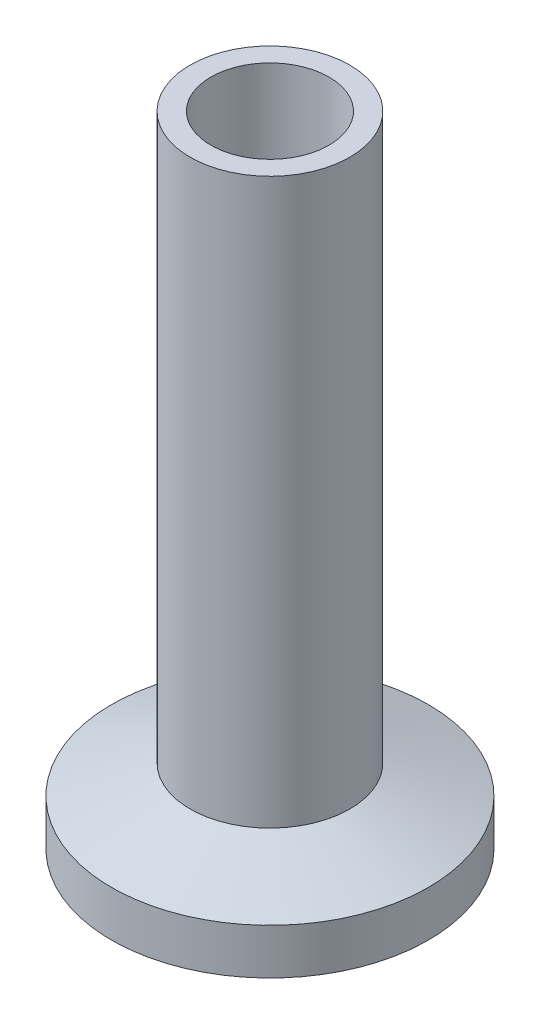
SolidWorks part; units mm, degrees
ref_plane "Front Plane" through (0, 0, 0) normal (0, 0, 1) x (1, 0, 0)
ref_plane "Top Plane" through (0, 0, 0) normal (0, 1, 0) x (1, 0, 0)
ref_plane "Right Plane" through (0, 0, 0) normal (1, 0, 0) x (0, 0, -1)
sketch "Sketch1" plane through (0, 0, 0) normal (0, 0, 1) x (1, 0, 0)
  line L0 (-4.699, 0.889) -> (-4.699, 50.8)
  line L1 (-4.699, 50.8) -> (-6.35, 50.8)
  line L2 (-6.35, 50.8) -> (-6.35, 5.9064)
  line L3 (-6.35, 5.9064) -> (-12.5984, 3.6322)
  line L4 (-12.5984, 3.6322) -> (-12.5984, 0)
  line L5 (-12.5984, 0) -> (-10.922, 0)
  line L6 (-10.922, 0) -> (-10.922, 1.3208)
  line L7 (0, 0) -> (0, 14.3564) construction
  line L8 (0, 0) -> (0, 52.4936) construction
  line L9 (-8.6024, 0.889) -> (-4.699, 0.889)
  line L10 (-9.5843, 1.853) -> (-8.6024, 0.889)
  arc A2 (-9.5843, 1.853) -> (-10.922, 1.3208) centre (-10.1473, 1.3208) ccw
  dimension "D7" = 10.1473
  dimension "D1" = 50.8
  dimension "D2" = 3.6322
  dimension "D3" = 110
  dimension "D4" = 4.699
  dimension "D5" = 6.35
  dimension "D8" = 10.922
  dimension "D9" = 12.5984
revolve "Revolve1" add sketch "Sketch1" angle 360 about L7
